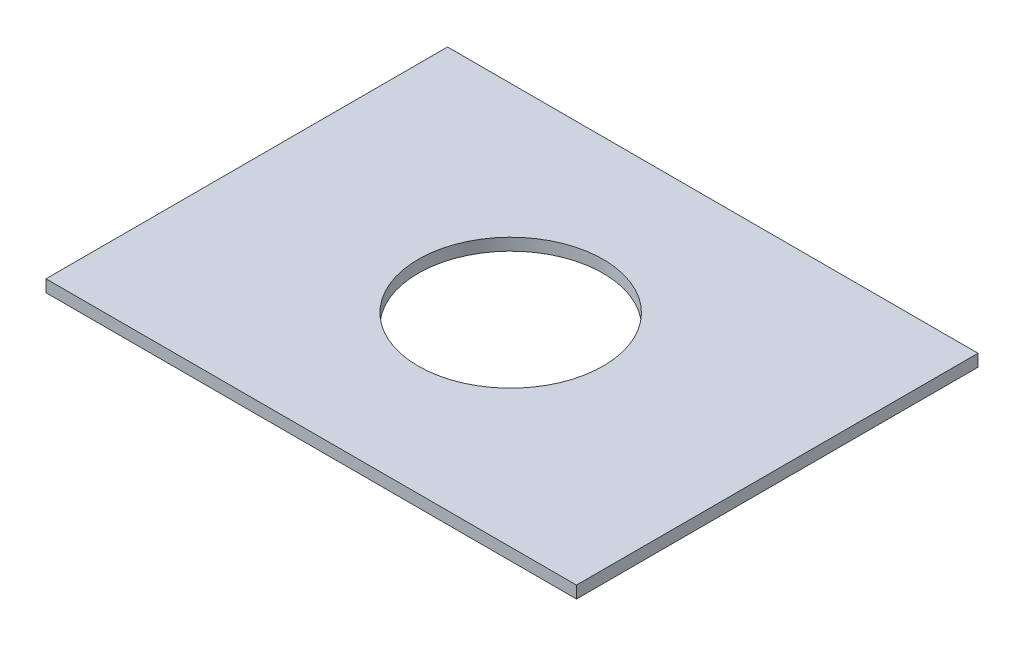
SolidWorks part; units mm, degrees
ref_plane "Front Plane" through (0, 0, 0) normal (0, 0, 1) x (1, 0, 0)
ref_plane "Top Plane" through (0, 0, 0) normal (0, 1, 0) x (1, 0, 0)
ref_plane "Right Plane" through (0, 0, 0) normal (1, 0, 0) x (0, 0, -1)
sketch "Sketch1" plane through (0, 0, 0) normal (0, 1, 0) x (1, 0, 0)
  line L1 (0, 0) -> (111.3575, 0)
  line L2 (0, 0) -> (0, 84.2861)
  line L3 (0, 84.2861) -> (111.3575, 84.2861)
  line L4 (111.3575, 0) -> (111.3575, 84.2861)
extrude "Extrude1" add sketch "Sketch1" along normal blind 2.54
sketch "Sketch2" plane through (0, 2.54, 0) normal (0, 1, 0) x (-1, 0, 0)
  circle A0 centre (-54.9361, -42.6072) radius 19.4132
extrude "Cut-Extrude1" cut sketch "Sketch2" against normal through all
